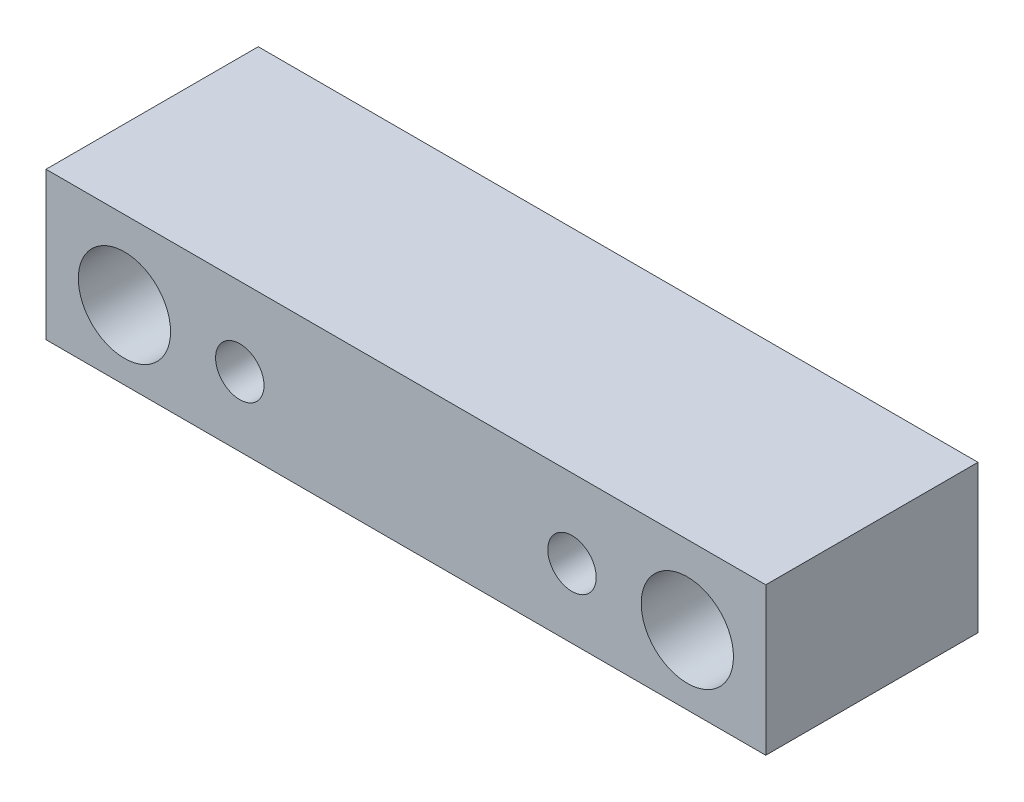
SolidWorks part; units mm, degrees
ref_plane "Plan de face" through (0, 0, 0) normal (0, 0, 1) x (1, 0, 0)
ref_plane "Plan de dessus" through (0, 0, 0) normal (0, 1, 0) x (1, 0, 0)
ref_plane "Plan de droite" through (0, 0, 0) normal (1, 0, 0) x (0, 0, -1)
sketch "Esquisse1" plane through (0, 0, 0) normal (0, 0, 1) x (1, 0, 0)
  line L1 (-78, 16) -> (78, 16)
  line L2 (-78, 16) -> (-78, -16)
  line L3 (-78, -16) -> (78, -16)
  line L4 (78, 16) -> (78, -16)
  point P4 (0, 16)
  point P6 (-78, 0)
  dimension "D1" = 156
  dimension "D2" = 32
extrude "Extrusion1" add sketch "Esquisse1" along normal blind 46
sketch "Esquisse2" plane through (0, 0, 46) normal (0, 0, 1) x (1, 0, 0)
  circle A0 centre (-61, -1) radius 10
  circle A1 centre (61, -1) radius 10
  circle A2 centre (-36, -1) radius 5.25
  circle A3 centre (36, -1) radius 5.25
  dimension "D1" = 20
  dimension "D2" = 20
  dimension "D3" = 10.5
  dimension "D4" = 10.5
  dimension "D5" = 1
  dimension "D6" = 122
  dimension "D7" = 61
  dimension "D8" = 72
  dimension "D9" = 36
extrude "Enlèv. mat.-Extru.1" cut sketch "Esquisse2" against normal through all
